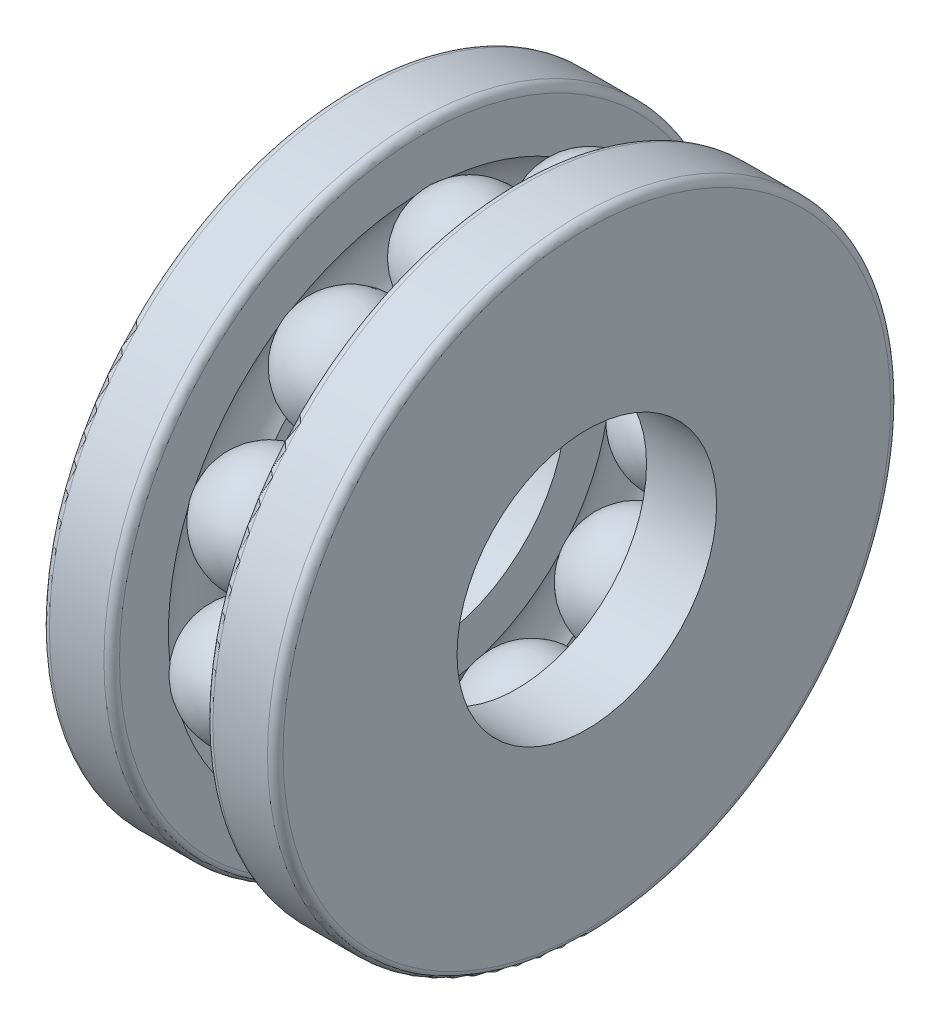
SolidWorks part; units mm, degrees
ref_plane "Front" through (0, 0, 0) normal (0, 0, 1) x (1, 0, 0)
ref_plane "Top" through (0, 0, 0) normal (0, 1, 0) x (1, 0, 0)
ref_plane "Right" through (0, 0, 0) normal (1, 0, 0) x (0, 0, -1)
sketch "Sketch1" plane through (0, 0, 0) normal (0, 0, 1) x (0, 1, 0)
  line L0 (0, 1.4099) -> (0, -1.5142) construction
  line L1 (6.25, 0) -> (10.75, 0)
  line L2 (4.3776, 0) -> (11.8663, 0) construction
  line L3 (8.5, 4.5) -> (13.0112, 4.5) construction
  line L4 (8.5, -4.5) -> (13.0112, -4.5) construction
  line L5 (5, 0) -> (5, 2.3607) construction
  line L6 (-5, 0) -> (-5, 2.3607) construction
  line L7 (12, 0) -> (12, 3.0588) construction
  line L8 (-12, 0) -> (-12, 3.0588) construction
  arc A0 (6.25, 0) -> (10.75, 0) centre (8.5, 0) ccw
  dimension "d0" = 4.5
  dimension "dd0" = 17
  dimension "T" = 9
  dimension "d" = 10
  dimension "DD" = 24
revolve "Revolve1" add sketch "Sketch1" angle 360 about L2
sketch "Sketch2" plane through (0, 0, 0) normal (0, 0, 1) x (0, 1, 0)
  line L0 (5.5, 4.5) -> (5.5, 1.8)
  line L1 (5.5, 1.8) -> (7.1836, 1.8)
  line L2 (5.5, 4.5) -> (12, 4.5)
  line L3 (12, 4.5) -> (12, 1.8)
  line L4 (12, 1.8) -> (9.8164, 1.8)
  line L5 (0, 4.8736) -> (0, -4.1797) construction
  line L6 (-8.0647, 0) -> (13.4529, 0) construction
  arc A0 (9.8164, 1.8) -> (7.1836, 1.8) centre (8.5, 0) ccw
  circle A1 centre (8.5, 0) radius 2.25 construction
  dimension "dd1" = 4.46
  dimension "D" = 24
  dimension "d1" = 11
  dimension "B1/2" = 1.8
  dimension "T" = 9
revolve "Revolve2" add sketch "Sketch2" angle 360 about L5
sketch "Sketch3" plane through (0, 0, 0) normal (0, 0, 1) x (0, 1, 0)
  line L0 (-2.5215, 0) -> (12.4263, 0) construction
  line L1 (5, -1.8) -> (7.1836, -1.8)
  line L2 (5, -1.8) -> (5, -4.5)
  line L3 (5, -4.5) -> (12, -4.5)
  line L4 (12, -1.8) -> (12, -4.5)
  line L5 (0, 8.7259) -> (0, -4.9884) construction
  line L6 (9.8164, -1.8) -> (12, -1.8)
  arc A0 (7.15, 1.8) -> (9.85, 1.8) centre (8.5, 0) ccw construction
  arc A1 (7.1836, -1.8) -> (9.8164, -1.8) centre (8.5, 0) ccw
  dimension "D1" = 4.46
  dimension "T" = 9
  dimension "DD1" = 24
  dimension "d" = 10
  dimension "D2" = 1.8
revolve "Revolve3" add sketch "Sketch3" angle 360 about L5
pattern_circular "Circular-Pattern1" count 11 over 360 about axis through (0, 0, 0) along (1, 0, 0) of "Revolve1"
fillet "Fillet1" radius 0.3 4 edges at (4.5, 0, 12) (1.8, 0, 12) (-1.8, 0, 12) (-4.5, 0, 12)
equation "\"d0@Sketch1\" = \"T@Sketch1\" / 2"
equation "\"dd0@Sketch1\" =  ( \"d@Sketch1\" + \"DD@Sketch1\" )  / 2"
equation "\"D@Sketch2\" = \"DD@Sketch1\""
equation "\"T@Sketch2\" = \"T@Sketch1\""
equation "\"dd1@Sketch2\" = \"d0@Sketch1\" - 0.04"
equation "\"B1/2@Sketch2\" = \"T@Sketch2\" / 5"
equation "\"d@Sketch3\" = \"d@Sketch1\""
equation "\"D2@Sketch3\" = \"B1/2@Sketch2\""
equation "\"D1@Sketch3\" = \"dd1@Sketch2\""
equation "\"T@Sketch3\" = \"T@Sketch2\""
equation "\"m@Circular-Pattern1\" = int( 3.14159265 / atn((  \"d0@Sketch1\"/ 2) / sqr( \"dd0@Sketch1\"/2 * \"dd0@Sketch1\"/2 - ( \"d0@Sketch1\"/ 2) *  ( \"d0@Sketch1\" / 2))))"
